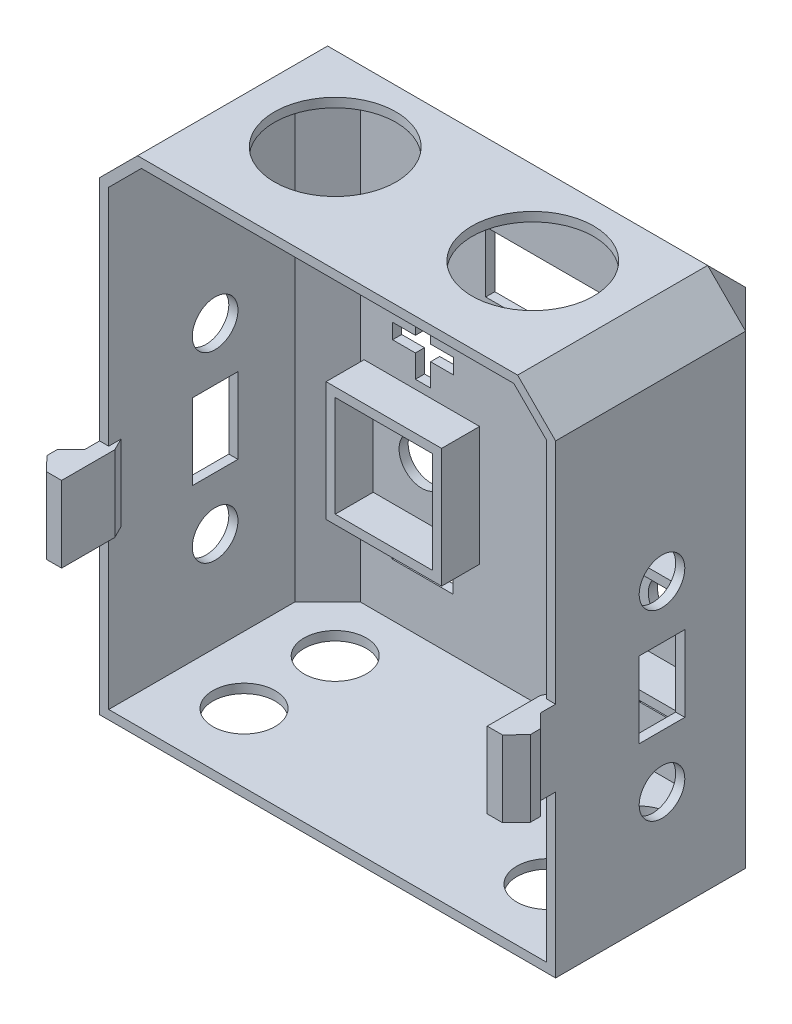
SolidWorks part; units mm, degrees
ref_plane "Alzado" through (0, 0, 0) normal (0, 0, 1) x (1, 0, 0)
ref_plane "Planta" through (0, 0, 0) normal (0, 1, 0) x (1, 0, 0)
ref_plane "Vista lateral" through (0, 0, 0) normal (1, 0, 0) x (0, 0, -1)
sketch "Croquis1" plane through (0, 0, 0) normal (0, 0, 1) x (1, 0, 0)
  line L1 (-30, -40) -> (30, -40)
  line L2 (-30, -40) -> (-30, 40)
  line L3 (-30, 40) -> (30, 40)
  line L4 (30, -40) -> (30, 40)
  line L5 (-30, -40) -> (30, 40) construction
  line L6 (-30, 40) -> (30, -40) construction
  point P0 (0, 0)
  dimension "D1" = 60
  dimension "D2" = 80
extrude "Saliente-Extruir2" add sketch "Croquis1" along normal blind 30
chamfer "Chaflán9" distance 5 angle 45 8 edges at (0, 40, 0) (-30, 40, 15) (-30, 0, 0) (-30, -40, 15) (0, -40, 0) (30, -40, 15) (30, 0, 0) (30, 40, 15)
shell "Vaciado1" thickness 1.2
sketch "Croquis2" plane through (0, 40, 0) normal (0, 1, 0) x (1, 0, 0)
  circle A1 centre (-13, -16) radius 8
  circle A2 centre (13, -16) radius 8
extrude "Cortar-Extruir1" cut sketch "Croquis2" against normal blind 40
sketch "Croquis3" plane through (30, 0, 0) normal (1, 0, 0) x (0, 0, -1)
  line L0 (-5, 35) -> (-16, 35)
  line L1 (-5, 35) -> (-30, 35) construction
  line L5 (-19, -5) -> (-13, -5)
  line L6 (-19, -5) -> (-19, 5)
  line L7 (-19, 5) -> (-13, 5)
  line L8 (-13, -5) -> (-13, 5)
  line L9 (-19, -5) -> (-13, 5) construction
  line L10 (-19, 5) -> (-13, -5) construction
  circle A0 centre (-16, 12) radius 3
  circle A1 centre (-16, -12) radius 3
  point P5 (-16, 0)
  dimension "D1" = 10
  dimension "D2" = 6
extrude "Cortar-Extruir2" cut sketch "Croquis3" against normal blind 70 contours L5 L8 L7 L6 | A0 | A1
sketch "Croquis4" plane through (0, -40, 0) normal (0, -1, 0) x (1, 0, 0)
  circle A0 centre (-6, 12) radius 4
  circle A1 centre (-6, 22) radius 4
  circle A2 centre (6, 12) radius 4
  circle A3 centre (6, 22) radius 4
extrude "Cortar-Extruir3" cut sketch "Croquis4" against normal blind 40
sketch "Croquis8" plane through (0, 0, 0) normal (0, 1, 0) x (1, 0, 0)
  line L0 (-30, -30) -> (-30, -32)
  line L4 (-30, -37) -> (-28, -37)
  line L5 (-28, -37) -> (-28, -30)
  line L6 (-25, -30) -> (-30, -30) construction
  line L9 (-30, -30) -> (-30, -5) construction
  line L10 (-30, -26) -> (-28, -30)
  line L11 (-30, -26) -> (-30, -30)
  line L13 (-31.8, -33.8) -> (-30, -32)
  line L15 (-31.8, -33.8) -> (-31.8, -35.1267)
  line L16 (-30, -37) -> (-31.8, -35.1267)
  point P5 (-32, -37)
extrude "Saliente-Extruir3" add sketch "Croquis8" along normal mid plane 10
mirror "Simetría1" about plane through (0, 0, 0) normal (1, 0, 0) of "Saliente-Extruir3"
sketch "Croquis12" plane through (0, 0, 30) normal (0, 0, 1) x (1, 0, 0)
  line L1 (-35.0425, -40) -> (42.3745, -40)
  line L2 (42.3745, -40) -> (42.3745, -25)
  line L3 (42.3745, -25) -> (-35.0425, -25)
  line L4 (-35.0425, -25) -> (-35.0425, -40)
extrude "Cortar-Extruir5" cut sketch "Croquis12" against normal blind 78
sketch "Croquis13" plane through (0, -25, 0) normal (0, -1, 0) x (1, 0, 0)
  line L0 (-28.8, 30) -> (28.8, 30)
  line L12 (30, 30) -> (28.8, 30)
  line L13 (28.8, 30) -> (28.8, 5.4971)
  line L14 (28.8, 5.4971) -> (24.5029, 1.2)
  line L15 (24.5029, 1.2) -> (-24.5029, 1.2)
  line L16 (-24.5029, 1.2) -> (-28.8, 5.4971)
  line L17 (-28.8, 5.4971) -> (-28.8, 30)
  line L18 (-28.8, 30) -> (-30, 30)
  line L19 (-30, 30) -> (-30, 5)
  line L20 (-30, 5) -> (-25, 0)
  line L21 (-25, 0) -> (25, 0)
  line L22 (25, 0) -> (30, 5)
  line L23 (30, 5) -> (30, 30)
  line L24 (30, 30) -> (28.8, 30)
  line L30 (-28.8, 30) -> (-30, 30)
  line L31 (-30, 30) -> (-30, 5)
  line L32 (-30, 5) -> (-25, 0)
  line L33 (-25, 0) -> (25, 0)
  line L34 (25, 0) -> (30, 5)
  line L35 (30, 5) -> (30, 30)
  dimension "D1" = 0
extrude "Saliente-Extruir4" add sketch "Croquis13" along normal blind 1.2
sketch "Croquis14" plane through (0, -26.2, 0) normal (0, -1, 0) x (1, 0, 0)
  circle A1 centre (-20, 9) radius 4.1
  circle A2 centre (-20, 21) radius 4.1
  circle A3 centre (20, 9) radius 4.1
  circle A4 centre (20, 21) radius 4.1
extrude "Cortar-Extruir6" cut sketch "Croquis14" against normal blind 1.2
sketch "Croquis15" plane through (0, 0, 0) normal (0, 0, -1) x (-1, 0, 0)
  line L0 (-17.3241, -16.0178) -> (-15.3241, -16.0178)
  line L1 (-17.4, 9) -> (-17.4, 12)
  line L2 (-17.4, 12) -> (-15.4, 12)
  line L3 (-15.4, 12) -> (-15.4, 9)
  line L4 (-15.4, 4) -> (-17.4, 4)
  line L5 (-17.4, 4) -> (-17.4, 7)
  line L6 (-17.4, 9) -> (-20.4, 9)
  line L7 (-20.4, 9) -> (-20.4, 7)
  line L8 (-20.4, 7) -> (-17.4, 7)
  line L9 (-12.4, 7) -> (-12.4, 9)
  line L10 (-12.4, 9) -> (-15.4, 9)
  line L11 (-15.4, 7) -> (-15.4, 4)
  line L12 (-15.4, 7) -> (-12.4, 7)
  line L14 (-17.3241, -18.0178) -> (-15.3241, -18.0178)
  line L15 (-15.3241, -16.0178) -> (-12.3241, -16.0178)
  line L16 (-12.3241, -16.0178) -> (-12.3241, -18.0178)
  line L17 (-12.3241, -18.0178) -> (-15.3241, -18.0178)
  line L21 (-17.3241, -18.0178) -> (-20.3241, -18.0178)
  line L22 (-20.3241, -18.0178) -> (-20.3241, -16.0178)
  line L23 (-20.3241, -16.0178) -> (-17.3241, -16.0178)
  line L28 (17.3241, -18.0178) -> (20.3241, -18.0178)
  line L29 (20.3241, -18.0178) -> (20.3241, -16.0178)
  line L30 (20.3241, -16.0178) -> (17.3241, -16.0178)
  line L31 (17.3241, -16.0178) -> (15.3241, -16.0178)
  line L32 (15.3241, -16.0178) -> (12.3241, -16.0178)
  line L33 (12.3241, -16.0178) -> (12.3241, -18.0178)
  line L34 (12.3241, -18.0178) -> (15.3241, -18.0178)
  line L35 (17.3241, -18.0178) -> (15.3241, -18.0178)
  line L36 (15.2482, 7) -> (15.2482, 4)
  line L37 (15.2482, 7) -> (12.2482, 7)
  line L38 (12.2482, 7) -> (12.2482, 9)
  line L39 (12.2482, 9) -> (15.2482, 9)
  line L40 (15.2482, 12) -> (15.2482, 9)
  line L41 (17.2482, 12) -> (15.2482, 12)
  line L42 (17.2482, 9) -> (17.2482, 12)
  line L43 (17.2482, 9) -> (20.2482, 9)
  line L44 (20.2482, 9) -> (20.2482, 7)
  line L45 (20.2482, 7) -> (17.2482, 7)
  line L46 (17.2482, 4) -> (17.2482, 7)
  line L47 (15.2482, 4) -> (17.2482, 4)
  line L49 (0, 26) -> (8, 26)
  line L50 (8, 26) -> (8, 18)
  line L51 (8, 18) -> (-8, 18)
  line L52 (-8, 18) -> (-8, 26)
  line L53 (-8, 26) -> (0, 26)
  circle A0 centre (-16.4, -5) radius 3
  circle A1 centre (16.4, -5) radius 3
extrude "Cortar-Extruir7" cut sketch "Croquis15" against normal blind 1.2
sketch "Croquis16" plane through (0, 0, 1.2) normal (0, 0, 1) x (1, 0, 0)
  line L0 (8.8, -12.85) -> (8.8, 2.85)
  line L1 (10, -11.65) -> (22.8, -11.65)
  line L2 (10, -11.65) -> (10, 1.65)
  line L3 (10, 1.65) -> (22.8, 1.65)
  line L4 (22.8, -11.65) -> (22.8, 1.65)
  line L5 (10, -11.65) -> (22.8, 1.65) construction
  line L6 (10, 1.65) -> (22.8, -11.65) construction
  line L7 (8.8, 2.85) -> (24, 2.85)
  line L8 (24, -12.85) -> (24, 2.85)
  line L9 (8.8, -12.85) -> (24, -12.85)
  point P0 (16.4, -5)
  dimension "D1" = 13.3
  dimension "D2" = 12.8
  dimension "D3" = 1.2
extrude "Saliente-Extruir5" add sketch "Croquis16" along normal blind 5
mirror "Simetría2" about plane through (0, 0, 0) normal (1, 0, 0) of "Saliente-Extruir5"
